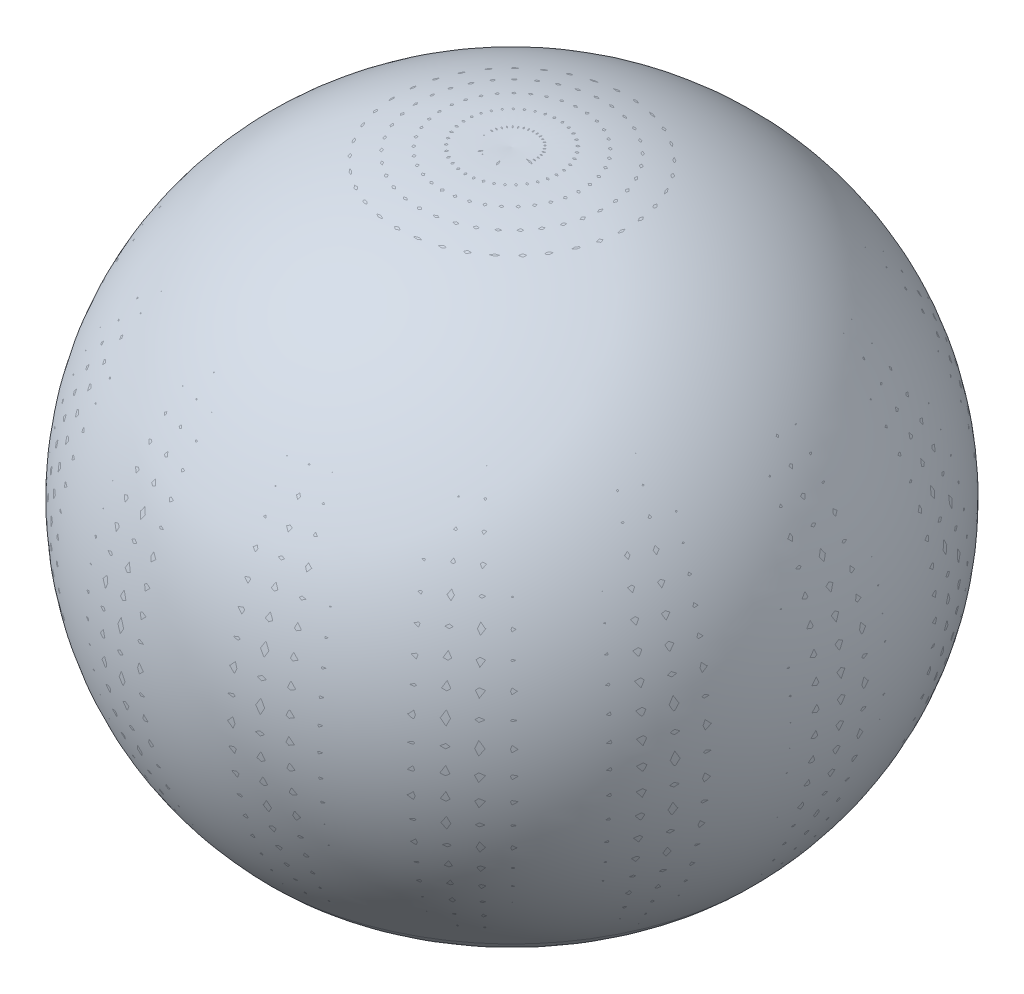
SolidWorks part; units mm, degrees
ref_plane "Front Plane" through (0, 0, 0) normal (0, 0, 1) x (1, 0, 0)
ref_plane "Top Plane" through (0, 0, 0) normal (0, 1, 0) x (1, 0, 0)
ref_plane "Right Plane" through (0, 0, 0) normal (1, 0, 0) x (0, 0, -1)
sketch "Sketch1" plane through (0, 0, 0) normal (0, 0, 1) x (1, 0, 0)
  line L0 (-571.6715, 33.9266) -> (-568.122, 11.0141)
  line L1 (-568.122, 11.0141) -> (-563.9918, -11.8225)
  line L2 (-563.9918, -11.8225) -> (-559.2783, -34.5631)
  line L3 (-559.2783, -34.5631) -> (-553.979, -57.188)
  line L4 (-553.979, -57.188) -> (-548.0912, -79.6769)
  line L5 (-548.0912, -79.6769) -> (-541.6124, -102.0102)
  line L6 (-541.6124, -102.0102) -> (-534.5398, -124.1676)
  line L7 (-534.5398, -124.1676) -> (-526.8709, -146.1294)
  line L8 (-526.8709, -146.1294) -> (-518.6031, -167.8755)
  line L9 (-518.6031, -167.8755) -> (-509.7338, -189.386)
  line L10 (-509.7338, -189.386) -> (-499.3003, -212.7176)
  line L11 (-499.3003, -212.7176) -> (-488.1596, -235.724)
  line L12 (-488.1596, -235.724) -> (-476.3331, -258.3884)
  line L13 (-476.3331, -258.3884) -> (-463.8425, -280.6939)
  line L14 (-463.8425, -280.6939) -> (-450.7092, -302.6235)
  line L15 (-450.7092, -302.6235) -> (-436.9547, -324.1605)
  line L16 (-436.9547, -324.1605) -> (-422.6007, -345.288)
  line L17 (-422.6007, -345.288) -> (-407.6685, -365.9891)
  line L18 (-407.6685, -365.9891) -> (-392.1798, -386.2469)
  line L19 (-392.1798, -386.2469) -> (-376.1561, -406.0445)
  line L20 (429.5597, 352.5656) -> (440.6609, 338.7826)
  line L21 (440.6609, 338.7826) -> (451.2804, 324.538)
  line L22 (451.2804, 324.538) -> (461.3718, 309.8584)
  line L23 (461.3718, 309.8584) -> (470.8891, 294.7704)
  line L24 (470.8891, 294.7704) -> (479.7858, 279.3007)
  line L25 (479.7858, 279.3007) -> (488.0158, 263.4759)
  line L26 (488.0158, 263.4759) -> (495.5329, 247.3224)
  line L27 (495.5329, 247.3224) -> (502.2908, 230.8671)
  line L28 (502.2908, 230.8671) -> (508.2432, 214.1364)
  line L29 (508.2432, 214.1364) -> (513.3439, 197.157)
  line L30 (513.3439, 197.157) -> (518.3287, 176.3405)
  line L31 (518.3287, 176.3405) -> (522.0532, 155.2563)
  line L32 (522.0532, 155.2563) -> (524.5691, 133.9609)
  line L33 (524.5691, 133.9609) -> (525.928, 112.5111)
  line L34 (525.928, 112.5111) -> (526.1816, 90.9636)
  line L35 (526.1816, 90.9636) -> (525.3816, 69.3751)
  line L36 (525.3816, 69.3751) -> (523.5797, 47.8024)
  line L37 (523.5797, 47.8024) -> (520.8274, 26.3021)
  line L38 (520.8274, 26.3021) -> (517.1766, 4.9309)
  line L39 (517.1766, 4.9309) -> (512.6788, -16.2544)
  line L40 (512.6788, -16.2544) -> (506.2899, -41.1421)
  line L41 (506.2899, -41.1421) -> (498.8128, -65.6627)
  line L42 (498.8128, -65.6627) -> (490.2842, -89.7923)
  line L43 (490.2842, -89.7923) -> (480.7408, -113.5067)
  line L44 (480.7408, -113.5067) -> (470.2192, -136.7821)
  line L45 (470.2192, -136.7821) -> (458.7561, -159.5944)
  line L46 (458.7561, -159.5944) -> (446.3884, -181.9196)
  line L47 (446.3884, -181.9196) -> (433.1525, -203.7338)
  line L48 (433.1525, -203.7338) -> (419.0853, -225.013)
  line L49 (419.0853, -225.013) -> (404.2234, -245.7331)
  line L50 (404.2234, -245.7331) -> (385.9908, -269.0953)
  line L51 (385.9908, -269.0953) -> (366.7828, -291.6586)
  line L52 (366.7828, -291.6586) -> (346.6487, -313.4124)
  line L53 (346.6487, -313.4124) -> (325.638, -334.3459)
  line L54 (325.638, -334.3459) -> (303.8001, -354.4486)
  line L55 (303.8001, -354.4486) -> (281.1842, -373.7097)
  line L56 (281.1842, -373.7097) -> (257.8398, -392.1187)
  line L57 (257.8398, -392.1187) -> (233.8163, -409.6649)
  line L58 (233.8163, -409.6649) -> (209.1629, -426.3377)
  line L59 (209.1629, -426.3377) -> (183.9292, -442.1263)
  line L60 (183.9292, -442.1263) -> (154.5765, -459.0007)
  line L61 (154.5765, -459.0007) -> (124.5919, -474.709)
  line L62 (124.5919, -474.709) -> (94.0305, -489.2431)
  line L63 (94.0305, -489.2431) -> (62.9478, -502.5949)
  line L64 (62.9478, -502.5949) -> (31.3989, -514.7562)
  line L65 (31.3989, -514.7562) -> (-0.5607, -525.7191)
  line L66 (-0.5607, -525.7191) -> (-32.8758, -535.4753)
  line L67 (-32.8758, -535.4753) -> (-65.4912, -544.0167)
  line L68 (-65.4912, -544.0167) -> (-98.3515, -551.3354)
  line L69 (-98.3515, -551.3354) -> (-131.4014, -557.4231)
  arc A0 (-1750.1243, 565) -> (-376.1561, -406.0445) centre (-720, 565) ccw
  arc A1 (-136.5475, 1413.9636) -> (-571.6715, 33.9266) centre (150, 565) ccw
  arc A2 (254.0081, 900.357) -> (-136.5475, 1413.9636) centre (-720, 565) ccw
  arc A3 (429.5597, 352.5656) -> (254.0081, 900.357) centre (150, 565) ccw
  arc A4 (-131.4014, -557.4231) -> (1493.5908, -778.5907) centre (765.1829, -50.1829) ccw
  arc A5 (1493.5908, -778.5907) -> (-1750.1243, 565) centre (150, 565) ccw
sketch "Sketch4" plane through (0, 0, 0) normal (0, 0, 1) x (1, 0, 0)
  line L0 (429.5597, 352.5656) -> (440.6609, 338.7826)
  line L1 (440.6609, 338.7826) -> (451.2804, 324.538)
  line L2 (451.2804, 324.538) -> (461.3718, 309.8584)
  line L3 (461.3718, 309.8584) -> (470.8891, 294.7704)
  line L4 (470.8891, 294.7704) -> (479.7858, 279.3007)
  line L5 (479.7858, 279.3007) -> (488.0158, 263.4759)
  line L6 (488.0158, 263.4759) -> (495.5329, 247.3224)
  line L7 (495.5329, 247.3224) -> (502.2908, 230.8671)
  line L8 (502.2908, 230.8671) -> (508.2432, 214.1364)
  line L9 (508.2432, 214.1364) -> (513.3439, 197.157)
  line L10 (513.3439, 197.157) -> (518.3287, 176.3405)
  line L11 (518.3287, 176.3405) -> (522.0532, 155.2563)
  line L12 (522.0532, 155.2563) -> (524.5691, 133.9609)
  line L13 (524.5691, 133.9609) -> (525.928, 112.5111)
  line L14 (525.928, 112.5111) -> (526.1816, 90.9636)
  line L15 (526.1816, 90.9636) -> (525.3816, 69.3751)
  line L16 (525.3816, 69.3751) -> (523.5797, 47.8024)
  line L17 (523.5797, 47.8024) -> (520.8274, 26.3021)
  line L18 (520.8274, 26.3021) -> (517.1766, 4.9309)
  line L19 (517.1766, 4.9309) -> (512.6788, -16.2544)
  line L20 (512.6788, -16.2544) -> (506.2899, -41.1421)
  line L21 (506.2899, -41.1421) -> (498.8128, -65.6627)
  line L22 (498.8128, -65.6627) -> (490.2842, -89.7923)
  line L23 (490.2842, -89.7923) -> (480.7408, -113.5067)
  line L24 (480.7408, -113.5067) -> (470.2192, -136.7821)
  line L25 (470.2192, -136.7821) -> (458.7561, -159.5944)
  line L26 (458.7561, -159.5944) -> (446.3884, -181.9196)
  line L27 (446.3884, -181.9196) -> (433.1525, -203.7338)
  line L28 (433.1525, -203.7338) -> (419.0853, -225.013)
  line L29 (419.0853, -225.013) -> (404.2234, -245.7331)
  line L30 (404.2234, -245.7331) -> (385.9908, -269.0953)
  line L31 (385.9908, -269.0953) -> (366.7828, -291.6586)
  line L32 (366.7828, -291.6586) -> (346.6487, -313.4124)
  line L33 (346.6487, -313.4124) -> (325.638, -334.3459)
  line L34 (325.638, -334.3459) -> (303.8001, -354.4486)
  line L35 (303.8001, -354.4486) -> (281.1842, -373.7097)
  line L36 (281.1842, -373.7097) -> (257.8398, -392.1187)
  line L37 (257.8398, -392.1187) -> (233.8163, -409.6649)
  line L38 (233.8163, -409.6649) -> (209.1629, -426.3377)
  line L39 (209.1629, -426.3377) -> (183.9292, -442.1263)
  line L40 (183.9292, -442.1263) -> (154.5765, -459.0007)
  line L41 (154.5765, -459.0007) -> (124.5919, -474.709)
  line L42 (124.5919, -474.709) -> (94.0305, -489.2431)
  line L43 (94.0305, -489.2431) -> (62.9478, -502.5949)
  line L44 (62.9478, -502.5949) -> (31.3989, -514.7562)
  line L45 (31.3989, -514.7562) -> (0, -525.5267)
  line L50 (0, 1301.7198) -> (0, 2459.1943)
  line L51 (0, -525.5267) -> (0, -739.8575)
  arc A0 (254.0081, 900.357) -> (0, 1301.7198) centre (-720, 565) ccw
  arc A1 (429.5597, 352.5656) -> (254.0081, 900.357) centre (150, 565) ccw
  arc A2 (0, -739.8575) -> (1493.5908, -778.5907) centre (765.1829, -50.1829) ccw
  arc A3 (1493.5908, -778.5907) -> (0, 2459.1943) centre (150, 565) ccw
sketch "Sketch5" plane through (0, 0, 0) normal (0, 0, 1) x (1, 0, 0)
  line L0 (-571.6715, 33.9266) -> (-568.122, 11.0141)
  line L1 (-568.122, 11.0141) -> (-563.9918, -11.8225)
  line L2 (-563.9918, -11.8225) -> (-559.2783, -34.5631)
  line L3 (-559.2783, -34.5631) -> (-553.979, -57.188)
  line L4 (-553.979, -57.188) -> (-548.0912, -79.6769)
  line L5 (-548.0912, -79.6769) -> (-541.6124, -102.0102)
  line L6 (-541.6124, -102.0102) -> (-534.5398, -124.1676)
  line L7 (-534.5398, -124.1676) -> (-526.8709, -146.1294)
  line L8 (-526.8709, -146.1294) -> (-518.6031, -167.8755)
  line L9 (-518.6031, -167.8755) -> (-509.7338, -189.386)
  line L10 (-509.7338, -189.386) -> (-499.3003, -212.7176)
  line L11 (-499.3003, -212.7176) -> (-488.1596, -235.724)
  line L12 (-488.1596, -235.724) -> (-476.3331, -258.3884)
  line L13 (-476.3331, -258.3884) -> (-463.8425, -280.6939)
  line L14 (-463.8425, -280.6939) -> (-450.7092, -302.6235)
  line L15 (-450.7092, -302.6235) -> (-436.9547, -324.1605)
  line L16 (-436.9547, -324.1605) -> (-422.6007, -345.288)
  line L17 (-422.6007, -345.288) -> (-407.6685, -365.9891)
  line L18 (-407.6685, -365.9891) -> (-392.1798, -386.2469)
  line L19 (-392.1798, -386.2469) -> (-376.1561, -406.0445)
  line L21 (0, 1301.7198) -> (0, 2459.1943)
  arc A0 (-1750.1243, 565) -> (-376.1561, -406.0445) centre (-720, 565) ccw
  arc A1 (-136.5475, 1413.9636) -> (-571.6715, 33.9266) centre (150, 565) ccw
  arc A2 (0, 1301.7198) -> (-136.5475, 1413.9636) centre (-720, 565) ccw
  arc A3 (0, 2459.1943) -> (-1750.1243, 565) centre (150, 565) ccw
revolve "Revolve-Thin1" add sketch "Sketch4" angle 360 about L50
revolve "Revolve-Thin2" add sketch "Sketch5" angle 360 about L21
